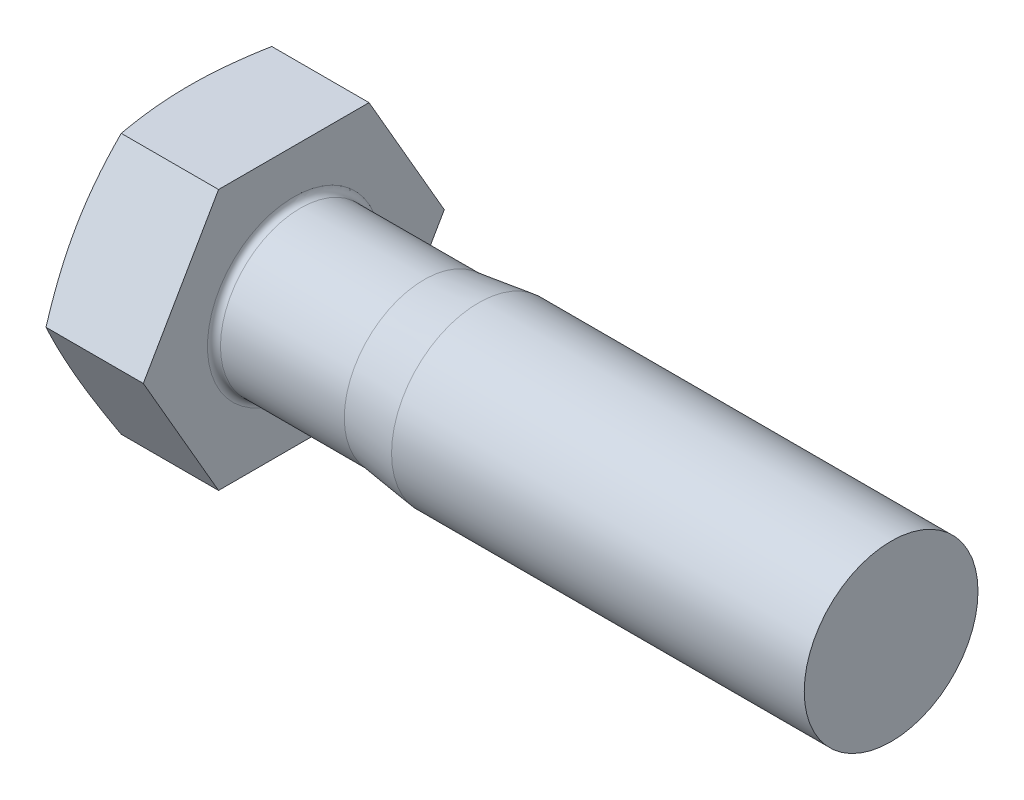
SolidWorks part; units mm, degrees
ref_plane "Front" through (0, 0, 0) normal (0, 0, 1) x (1, 0, 0)
ref_plane "Top" through (0, 0, 0) normal (0, 1, 0) x (1, 0, 0)
ref_plane "Right" through (0, 0, 0) normal (1, 0, 0) x (0, 0, -1)
sketch "Sketch1" plane through (0, 0, 0) normal (1, 0, 0) x (0, 0, -1)
  line L1 (13.8564, 0) -> (6.9282, 12)
  line L2 (6.9282, 12) -> (-6.9282, 12)
  line L3 (-6.9282, 12) -> (-13.8564, 0)
  line L4 (-13.8564, 0) -> (-6.9282, -12)
  line L5 (-6.9282, -12) -> (6.9282, -12)
  line L6 (6.9282, -12) -> (13.8564, 0)
  circle A0 centre (0, 0) radius 12 construction
  dimension "s" = 24
extrude "BaseHead" add sketch "Sketch1" along normal blind 10
ref_plane "Plane1" through (27, 0, 0) normal (1, 0, 0) x (0, 0, -1)
sketch "Sketch2" plane through (10, 0, 0) normal (1, 0, 0) x (0, 0, -1)
  circle A0 centre (0, 0) radius 8
  dimension "d" = 16
extrude "BaseBody" add sketch "Sketch2" along normal blind 55
sketch "Sketch3" plane through (3.1612, 0, 2.6123) normal (0, 1, 0) x (0, 0, -1)
  line L0 (2.6123, 5.2326) -> (2.6123, 1.6388) construction
  line L2 (16.4687, 3.1612) -> (16.4687, 2.1216)
  line L3 (16.4687, 2.1216) -> (13.6123, 3.1612)
  line L5 (13.6123, 3.1612) -> (16.4687, 3.1612)
  dimension "D1" = 20
  dimension "dw" = 22
revolve "HeadChamfer" cut sketch "Sketch3" angle 360 about L0
sketch "Sketch4" plane through (0, 0, 0) normal (-1, 0, 0) x (0, 0, 1)
  circle A0 centre (0, 0) radius 8.85
  dimension "da" = 17.7
extrude "Cut-Extrude1" cut sketch "Sketch4" against normal blind 2
sketch "Sketch5" plane through (-2.6796, 0, 8.1796) normal (0, 1, 0) x (0, 0, -1)
  line L0 (8.1796, 0.0175) -> (8.1796, -16.2361) construction
  line L2 (16.1796, -29.6796) -> (15.5301, -24.6796)
  line L4 (15.5301, -24.6796) -> (15.5301, -12.6796)
  line L6 (15.5301, -12.6796) -> (22.8806, -12.6796)
  line L7 (22.8806, -12.6796) -> (22.8806, -29.6796)
  line L8 (22.8806, -29.6796) -> (16.1796, -29.6796)
  line L11 (8.1796, -67.6796) -> (8.1796, -12.6796) construction
  line L14 (15.1078, -12.6796) -> (1.2514, -12.6796) construction
  line L16 (0.1796, -67.6796) -> (16.1796, -67.6796) construction
  line L17 (16.1796, -67.6796) -> (16.1796, -12.6796) construction
  dimension "ds" = 14.701
  dimension "x" = 5
  dimension "D3" = 38
  dimension "D4" = 29.402
revolve "Cut-Revolve1" cut sketch "Sketch5" angle 360 about L0
fillet "HeadFillet" radius 0.6 1 edges at (10, 0, 7.3505)
equation "\"D1@Cut-Extrude1\" = 0.2 * \"k@BaseHead\""
equation "\"b@ThreadCosmetic1\" = \"l@BaseBody\" - \"lg@Plane1\""
equation "\"D4@Sketch5\" = 2 * \"ds@Sketch5\""
equation "\"D3@Sketch5\" = \"l@BaseBody\" - \"lg@Plane1\""
